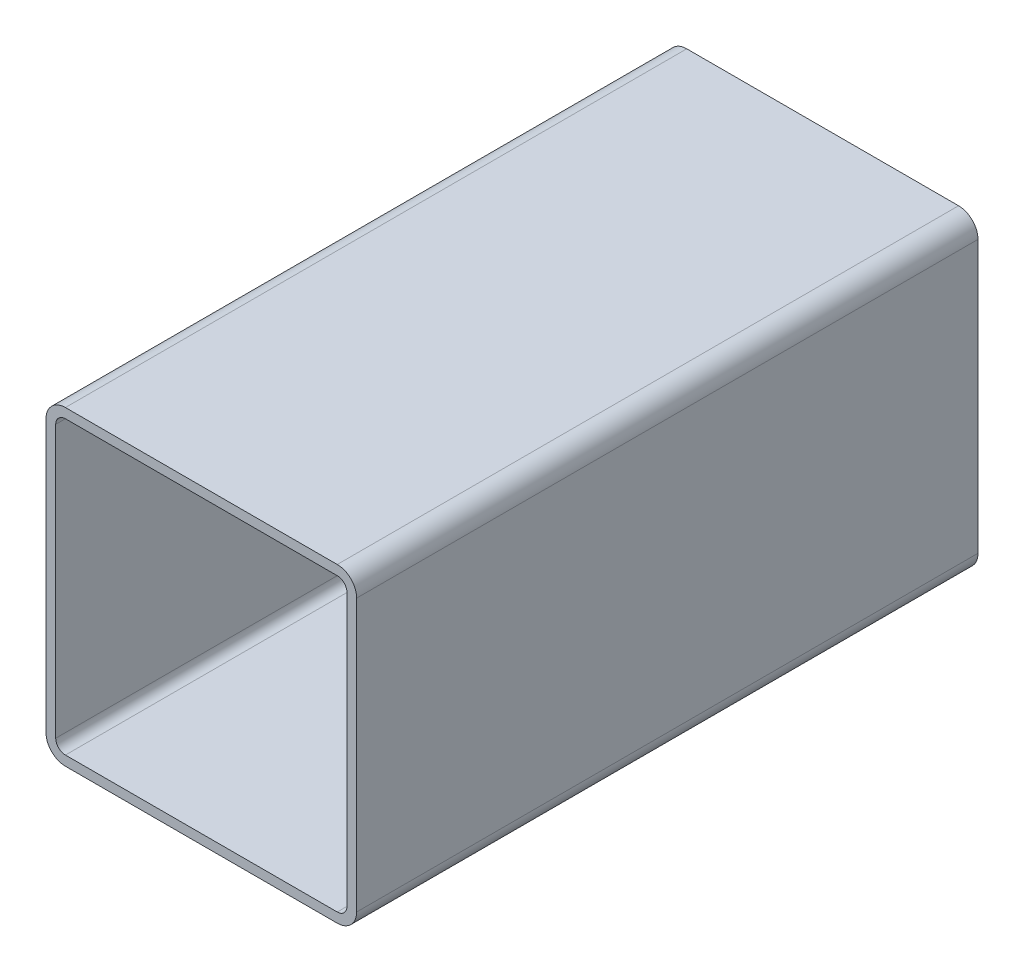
SolidWorks part; units mm, degrees
ref_plane "Front Plane" through (0, 0, 0) normal (0, 0, 1) x (1, 0, 0)
ref_plane "Top Plane" through (0, 0, 0) normal (0, 1, 0) x (1, 0, 0)
ref_plane "Right Plane" through (0, 0, 0) normal (1, 0, 0) x (0, 0, -1)
sketch "Sketch1" plane through (0, 0, 0) normal (0, 0, 1) x (1, 0, 0)
sketch_block_instance "HSS6x6x0.1875-1"
sketch_block "HSS6x6x0.1875"
extrude "Boss-Extrude1" add sketch "Sketch1" along normal blind 304.8
